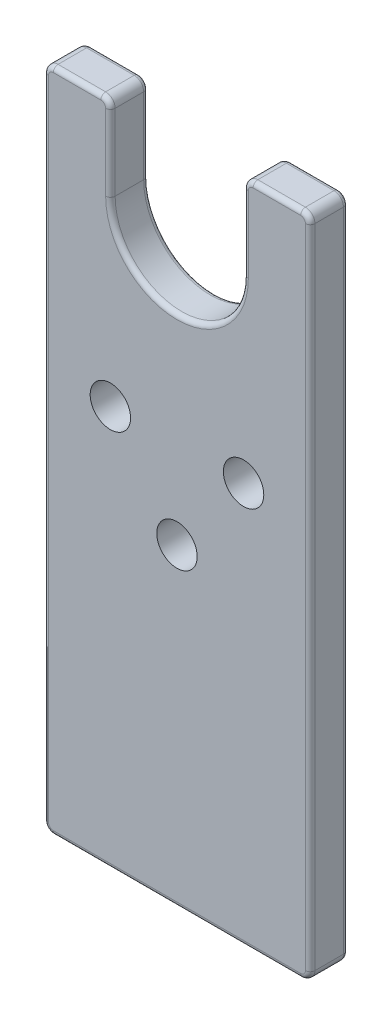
SolidWorks part; units mm, degrees
ref_plane "Front" through (0, 0, 0) normal (0, 0, 1) x (1, 0, 0)
ref_plane "Top" through (0, 0, 0) normal (0, 1, 0) x (1, 0, 0)
ref_plane "Right" through (0, 0, 0) normal (1, 0, 0) x (0, 0, -1)
sketch "Sketch1" plane through (0, 0, 0) normal (0, 0, 1) x (1, 0, 0)
  line L0 (0, 0) -> (88.9, 0)
  line L1 (0, 0) -> (0, 222.25)
  line L2 (88.9, 222.25) -> (66.675, 222.25)
  line L3 (88.9, 222.25) -> (88.9, 0)
  line L4 (44.45, 0) -> (44.45, 193.675) construction
  line L5 (22.225, 222.25) -> (22.225, 193.675)
  line L6 (66.675, 222.25) -> (66.675, 193.675)
  line L7 (22.225, 222.25) -> (0, 222.25)
  arc A0 (22.225, 193.675) -> (66.675, 193.675) centre (44.45, 193.675) ccw
  circle A4 centre (22.225, 133.7392) radius 6.7437
  circle A5 centre (44.45, 104.775) radius 6.7437
  circle A6 centre (66.675, 133.7392) radius 6.7437
  dimension "D3" = 28.575
  dimension "D4" = 44.45
  dimension "D6" = 117.475
  dimension "D7" = 13.4874
  dimension "D8" = 44.45
  dimension "D5" = 88.5108
  dimension "D1" = 222.25
  dimension "D2" = 88.9
extrude "Base-Extrude" add sketch "Sketch1" along normal blind 12.7
fillet "Fillet1" radius 3.175 6 edges at (0, 0, 6.35) (88.9, 0, 6.35) (88.9, 222.25, 6.35) (66.675, 222.25, 6.35) (22.225, 222.25, 6.35) (0, 222.25, 6.35)
fillet "Fillet2" radius 1.5875 28 edges at (44.45, 171.45, 12.7) (11.1125, 222.25, 0) (11.1125, 222.25, 12.7) (0, 111.125, 0) (22.225, 206.375, 0) (66.675, 206.375, 0) (77.7875, 222.25, 0) (88.9, 111.125, 0) (44.45, 0, 0) (0.9299, 0.9299, 0) (87.9701, 0.9299, 0) (87.9701, 221.3201, 0) (0.9299, 221.3201, 0) (67.6049, 221.3201, 0) (21.2951, 221.3201, 0) (22.225, 206.375, 12.7) (0, 111.125, 12.7) (44.45, 0, 12.7) (88.9, 111.125, 12.7) (77.7875, 222.25, 12.7) (66.675, 206.375, 12.7) (0.9299, 0.9299, 12.7) (87.9701, 0.9299, 12.7) (87.9701, 221.3201, 12.7) (0.9299, 221.3201, 12.7) (67.6049, 221.3201, 12.7) (21.2951, 221.3201, 12.7) (44.45, 171.45, 0)
